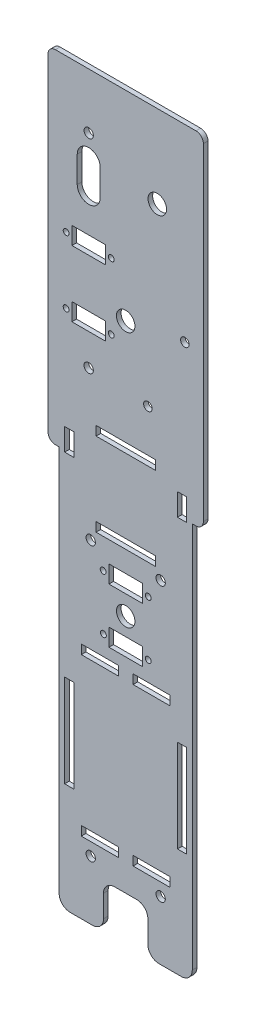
SolidWorks part; units mm, degrees
ref_plane "Front Plane" through (0, 0, 0) normal (0, 0, 1) x (1, 0, 0)
ref_plane "Top Plane" through (0, 0, 0) normal (0, 1, 0) x (1, 0, 0)
ref_plane "Right Plane" through (0, 0, 0) normal (1, 0, 0) x (0, 0, -1)
sketch "Sketch1" plane through (0, 0, 0) normal (0, 0, 1) x (1, 0, 0)
  line L1 (-26.67, -127) -> (26.67, -127)
  line L2 (-26.67, -127) -> (-26.67, 127)
  line L3 (-26.67, 127) -> (26.67, 127)
  line L4 (26.67, -127) -> (26.67, 127)
  line L5 (-26.67, -127) -> (26.67, 127) construction
  line L6 (-26.67, 127) -> (26.67, -127) construction
  point P0 (0, 0)
  dimension "D1" = 254
  dimension "D2" = 53.34
extrude "Boss-Extrude1" add sketch "Sketch1" along normal blind 1.5875
sketch "Sketch2" plane through (0, 0, 1.5875) normal (0, 0, 1) x (1, 0, 0)
  line L0 (0, 127) -> (0, -127) construction
  line L1 (26.67, 127) -> (-26.67, 127) construction
  line L2 (-26.67, -127) -> (26.67, -127) construction
  line L3 (35.56, -130.175) -> (22.86, -130.175)
  line L4 (-35.56, 9.525) -> (-22.86, 9.525)
  line L5 (-35.56, 9.525) -> (-35.56, -130.175)
  line L6 (-35.56, -130.175) -> (-22.86, -130.175)
  line L7 (-22.86, 9.525) -> (-22.86, -130.175)
  line L8 (22.86, 9.525) -> (22.86, -130.175)
  line L9 (35.56, 9.525) -> (22.86, 9.525)
  line L10 (35.56, 9.525) -> (35.56, -130.175)
  dimension "D1" = 139.7
  dimension "D2" = 22.86
  dimension "D3" = 117.475
  dimension "D4" = 12.7
extrude "Cut-Extrude1" cut sketch "Sketch2" against normal through all
sketch "Sketch3" plane through (0, 0, 1.5875) normal (0, 0, 1) x (1, 0, 0)
  line L0 (0, -127) -> (0, 0.6319) construction
  line L1 (-22.86, -127) -> (22.86, -127) construction
  line L3 (-7.62, -111.76) -> (7.62, -111.76)
  line L4 (-7.62, -111.76) -> (-7.62, -149.86)
  line L5 (-7.62, -149.86) -> (7.62, -149.86)
  line L6 (7.62, -111.76) -> (7.62, -149.86)
  line L7 (-7.62, -111.76) -> (7.62, -149.86) construction
  line L8 (-7.62, -149.86) -> (7.62, -111.76) construction
  point P5 (0, -130.81)
  dimension "D1" = 38.1
  dimension "D2" = 15.24
  dimension "D3" = 22.86
extrude "Cut-Extrude2" cut sketch "Sketch3" against normal through all
fillet "Fillet1" radius 3.81 6 edges at (-7.62, -111.76, 0.7937) (7.62, -111.76, 0.7937) (22.86, -127, 0.7937) (7.62, -127, 0.7937) (-7.62, -127, 0.7937) (-22.86, -127, 0.7937)
fillet "Fillet2" radius 2.54 4 edges at (-26.67, 9.525, 0.7937) (26.67, 9.525, 0.7937) (-26.67, 127, 0.7937) (26.67, 127, 0.7937)
hole_wizard "#4 Clearance Hole1" positions "Sketch5" profile "Sketch6" hole size "#4" standard "ANSI Inch"
sketch "Sketch5" plane through (0, 0, 1.5875) normal (0, 0, 1) x (1, 0, 0)
  line L0 (0, 127) -> (0, -111.76) construction
  line L1 (24.13, 127) -> (-24.13, 127) construction
  line L2 (3.81, -111.76) -> (-3.81, -111.76) construction
  point P8 (20.32, 62.23)
  point P10 (7.62, 36.83)
  point P14 (-39.4496, 54.198)
  dimension "D1" = 64.77
  dimension "D2" = 90.17
  dimension "D3" = 20.32
  dimension "D4" = 7.62
sketch "Sketch6" plane through (-39.4496, 54.198, 1.5875) normal (1, 0, 0) x (0, -1, 0)
  line L0 (0, 0) -> (0, 1.5875)
  line L1 (0, 1.5875) -> (1.4732, 1.5875)
  line L2 (1.4732, 1.5875) -> (1.4732, 0)
  line L5 (1.4732, 0) -> (0, 0)
  line L11 (0, -6.35) -> (0, 107.95) construction
  dimension "Thru Hole Dia." = 2.9464
  dimension "Thru Hole Depth" = 1.5875
sketch "Sketch7" plane through (0, 0, 1.5875) normal (0, 0, 1) x (1, 0, 0)
  line L0 (0, 127) -> (0, -111.76) construction
  line L1 (24.13, 127) -> (-24.13, 127) construction
  line L2 (3.81, -111.76) -> (-3.81, -111.76) construction
  line L4 (-15, -9.7355) -> (15, -9.7355)
  line L5 (-15, -9.7355) -> (-15, -109.7355)
  line L6 (-15, -109.7355) -> (15, -109.7355)
  line L7 (15, -9.7355) -> (15, -109.7355)
  line L8 (-15, -9.7355) -> (15, -109.7355) construction
  line L9 (-15, -109.7355) -> (15, -9.7355) construction
  point P6 (0, -59.7355)
  dimension "D1" = 100
  dimension "D2" = 30
hole_wizard "M3 Clearance Hole2" positions "Sketch8" profile "Sketch9" hole size "M3" standard "ANSI Metric"
sketch "Sketch8" plane through (0, 0, 1.5875) normal (0, 0, 1) x (1, 0, 0)
  line L0 (-15, -9.7355) -> (15, -9.7355) construction
  line L1 (-15, -9.7355) -> (-15, -109.7355) construction
  line L2 (15, -9.7355) -> (15, -109.7355) construction
  line L3 (-15, -109.7355) -> (15, -109.7355) construction
  point P0 (-12, -12.7355)
  point P2 (12, -12.7355)
  point P4 (12, -106.7355)
  point P6 (-12, -106.7355)
  dimension "D1" = 3
  dimension "D2" = 3
  dimension "D3" = 3
  dimension "D4" = 3
  dimension "D5" = 3
  dimension "D6" = 3
  dimension "D7" = 3
  dimension "D8" = 3
sketch "Sketch9" plane through (-12, -12.7355, 1.5875) normal (1, 0, 0) x (0, -1, 0)
  line L0 (0, 0) -> (0, 1.5875)
  line L1 (0, 1.5875) -> (1.6, 1.5875)
  line L2 (1.6, 1.5875) -> (1.6, 0)
  line L5 (1.6, 0) -> (0, 0)
  line L11 (0, -6.35) -> (0, 107.95) construction
  dimension "Thru Hole Dia." = 3.2
  dimension "Thru Hole Depth" = 1.5875
hole_wizard "M3 Clearance Hole3" positions "Sketch10" profile "Sketch11" hole size "M3" standard "ANSI Metric"
sketch "Sketch10" plane through (0, 0, 1.5875) normal (0, 0, 1) x (1, 0, 0)
  line L0 (-12.7, 127) -> (-12.7, 6.0622) construction
  line L1 (24.13, 127) -> (-24.13, 127) construction
  line L3 (0, 127) -> (0, -111.76) construction
  point P9 (-12.7, 107.95)
  point P11 (-12.7, 38.1)
  dimension "D1" = 12.7
  dimension "D2" = 19.05
  dimension "D3" = 69.85
sketch "Sketch11" plane through (-12.7, 38.1, 1.5875) normal (1, 0, 0) x (0, -1, 0)
  line L0 (0, 0) -> (0, 1.5875)
  line L1 (0, 1.5875) -> (1.6, 1.5875)
  line L2 (1.6, 1.5875) -> (1.6, 0)
  line L5 (1.6, 0) -> (0, 0)
  line L11 (0, -6.35) -> (0, 107.95) construction
  dimension "Thru Hole Dia." = 3.2
  dimension "Thru Hole Depth" = 1.5875
sketch "Sketch12" plane through (0, 0, 1.5875) normal (0, 0, 1) x (1, 0, 0)
  line L0 (0, 127) -> (0, -111.76) construction
  line L1 (17.78, -57.9609) -> (20.955, -57.9609)
  line L2 (17.78, -57.9609) -> (17.78, -89.7109)
  line L3 (17.78, -89.7109) -> (20.955, -89.7109)
  line L4 (20.955, -57.9609) -> (20.955, -89.7109)
  line L5 (17.78, -57.9609) -> (20.955, -89.7109) construction
  line L6 (17.78, -89.7109) -> (20.955, -57.9609) construction
  line L7 (-15.0182, -73.8359) -> (15.24, -73.8359) construction
  line L8 (2.54, -45.2609) -> (15.24, -45.2609)
  line L9 (2.54, -45.2609) -> (2.54, -48.4359)
  line L10 (2.54, -48.4359) -> (15.24, -48.4359)
  line L11 (15.24, -45.2609) -> (15.24, -48.4359)
  line L12 (2.54, -45.2609) -> (15.24, -48.4359) construction
  line L13 (2.54, -48.4359) -> (15.24, -45.2609) construction
  line L14 (2.54, -99.2359) -> (15.24, -102.4109) construction
  line L15 (2.54, -102.4109) -> (15.24, -99.2359) construction
  line L16 (15.24, -102.4109) -> (15.24, -99.2359)
  line L17 (2.54, -99.2359) -> (15.24, -99.2359)
  line L18 (2.54, -102.4109) -> (2.54, -99.2359)
  line L19 (2.54, -102.4109) -> (15.24, -102.4109)
  line L20 (0, -35.1674) -> (0, -106.1323) construction
  line L21 (-2.54, -48.4359) -> (-15.24, -45.2609) construction
  line L22 (-2.54, -45.2609) -> (-15.24, -48.4359) construction
  line L23 (-15.24, -45.2609) -> (-15.24, -48.4359)
  line L24 (-2.54, -48.4359) -> (-15.24, -48.4359)
  line L25 (-2.54, -45.2609) -> (-2.54, -48.4359)
  line L26 (-2.54, -45.2609) -> (-15.24, -45.2609)
  line L27 (-2.54, -102.4109) -> (-15.24, -99.2359) construction
  line L28 (-2.54, -99.2359) -> (-15.24, -102.4109) construction
  line L29 (-2.54, -102.4109) -> (-15.24, -102.4109)
  line L30 (-2.54, -102.4109) -> (-2.54, -99.2359)
  line L31 (-2.54, -99.2359) -> (-15.24, -99.2359)
  line L32 (-15.24, -102.4109) -> (-15.24, -99.2359)
  line L33 (-17.78, -89.7109) -> (-20.955, -57.9609) construction
  line L34 (-17.78, -57.9609) -> (-20.955, -89.7109) construction
  line L35 (-20.955, -57.9609) -> (-20.955, -89.7109)
  line L36 (-17.78, -89.7109) -> (-20.955, -89.7109)
  line L37 (-17.78, -57.9609) -> (-17.78, -89.7109)
  line L38 (-17.78, -57.9609) -> (-20.955, -57.9609)
  circle A0 centre (12, -106.7355) radius 1.6 construction
  point P0 (19.3675, -73.8359)
  point P7 (8.89, -46.8484)
  point P20 (8.89, -100.8234)
  point P28 (-8.89, -46.8484)
  point P33 (-8.89, -100.8234)
  point P38 (-19.3675, -73.8359)
  dimension "D1" = 3.175
  dimension "D2" = 31.75
  dimension "D3" = 17.78
  dimension "D4" = 3.175
  dimension "D5" = 12.7
  dimension "D6" = 8.89
  dimension "D7" = 32.8996
  dimension "D8" = 25.4
extrude "Cut-Extrude3" cut sketch "Sketch12" against normal through all
sketch "Sketch13" plane through (0, 0, 1.5875) normal (0, 0, 1) x (1, 0, 0)
  line L0 (0, 50.9824) -> (0, -22.1444) construction
  line L1 (-22.86, 6.3812) -> (22.86, 6.3812) construction
  line L2 (-10.16, -6.3188) -> (10.16, -6.3188)
  line L3 (-10.16, -6.3188) -> (-10.16, -9.4938)
  line L4 (-10.16, -9.4938) -> (10.16, -9.4938)
  line L5 (10.16, -6.3188) -> (10.16, -9.4938)
  line L6 (-10.16, -6.3188) -> (10.16, -9.4938) construction
  line L7 (-10.16, -9.4938) -> (10.16, -6.3188) construction
  line L8 (-22.86, -123.19) -> (-22.86, 9.525) construction
  line L9 (22.86, 9.525) -> (22.86, -123.19) construction
  line L10 (-10.16, 22.2562) -> (10.16, 19.0812) construction
  line L11 (-10.16, 19.0812) -> (10.16, 22.2562) construction
  line L12 (10.16, 19.0812) -> (10.16, 22.2562)
  line L13 (-10.16, 22.2562) -> (10.16, 22.2562)
  line L14 (-10.16, 19.0812) -> (-10.16, 22.2562)
  line L15 (-10.16, 19.0812) -> (10.16, 19.0812)
  line L16 (-17.78, 8.9212) -> (-20.955, 16.5412) construction
  line L17 (17.78, 16.5412) -> (20.955, 16.5412)
  line L18 (17.78, 16.5412) -> (17.78, 8.9212)
  line L19 (17.78, 8.9212) -> (20.955, 8.9212)
  line L20 (20.955, 16.5412) -> (20.955, 8.9212)
  line L21 (17.78, 16.5412) -> (20.955, 8.9212) construction
  line L22 (17.78, 8.9212) -> (20.955, 16.5412) construction
  line L23 (-17.78, 16.5412) -> (-20.955, 8.9212) construction
  line L24 (-20.955, 16.5412) -> (-20.955, 8.9212)
  line L25 (-17.78, 8.9212) -> (-20.955, 8.9212)
  line L26 (-17.78, 16.5412) -> (-17.78, 8.9212)
  line L27 (-17.78, 16.5412) -> (-20.955, 16.5412)
  point P3 (0, -7.9063)
  point P19 (0, 20.6687)
  point P20 (19.3675, 12.7312)
  point P28 (-19.3675, 12.7312)
  dimension "D1" = 3.175
  dimension "D2" = 20.32
  dimension "D3" = 25.4
  dimension "D4" = 7.62
  dimension "D5" = 3.175
  dimension "D6" = 17.78
  dimension "D7" = 6.35
extrude "Cut-Extrude4" cut sketch "Sketch13" against normal through all
sketch "Sketch15" plane through (0, 0, 1.5875) normal (0, 0, 1) x (1, 0, 0)
  line L0 (-12.7, 107.95) -> (-12.7, 38.1) construction
  line L1 (-12.7, 99.6778) -> (-12.7, 90.658) construction
  line L2 (-8.7632, 99.6778) -> (-8.7632, 90.658)
  line L3 (-16.6368, 99.6778) -> (-16.6368, 90.658)
  arc A0 (-8.7632, 99.6778) -> (-16.6368, 99.6778) centre (-12.7, 99.6778) ccw
  arc A1 (-16.6368, 90.658) -> (-8.7632, 90.658) centre (-12.7, 90.658) ccw
  point P6 (-12.7, 95.1679)
extrude "Cut-Extrude5" cut sketch "Sketch15" against normal blind 2.54
hole_wizard "1/4 (0.25) Diameter Hole1" positions "Sketch16" profile "Sketch17" hole size "1/4" standard "ANSI Inch"
sketch "Sketch16" plane through (0, 0, 1.5875) normal (0, 0, 1) x (1, 0, 0)
  point P0 (10.846, 98.5861)
  point P2 (0, 58.4037)
  point P4 (0, -29.3846)
sketch "Sketch17" plane through (10.846, 98.5861, 1.5875) normal (1, 0, 0) x (0, -1, 0)
  line L0 (0, 0) -> (0, 1.5875)
  line L1 (0, 1.5875) -> (3.175, 1.5875)
  line L2 (3.175, 1.5875) -> (3.175, 0)
  line L5 (3.175, 0) -> (0, 0)
  line L11 (0, -6.35) -> (0, 107.95) construction
  dimension "Thru Hole Dia." = 6.35
  dimension "Thru Hole Depth" = 1.5875
sketch "Sketch19" plane through (0, 0, 1.5875) normal (0, 0, 1) x (1, 0, 0)
  line L0 (-12.7, 107.95) -> (-12.7, 38.1) construction
  line L2 (-18.4531, 54.9218) -> (-6.9469, 54.9218)
  line L3 (-18.4531, 54.9218) -> (-18.4531, 48.9274)
  line L4 (-18.4531, 48.9274) -> (-6.9469, 48.9274)
  line L5 (-6.9469, 54.9218) -> (-6.9469, 48.9274)
  line L6 (-18.4531, 54.9218) -> (-6.9469, 48.9274) construction
  line L7 (-18.4531, 48.9274) -> (-6.9469, 54.9218) construction
  line L12 (-18.4531, 77.5988) -> (-6.9469, 77.5988)
  line L13 (-18.4531, 77.5988) -> (-18.4531, 71.6044)
  line L14 (-18.4531, 71.6044) -> (-6.9469, 71.6044)
  line L15 (-6.9469, 77.5988) -> (-6.9469, 71.6044)
  line L16 (-18.4531, 77.5988) -> (-6.9469, 71.6044) construction
  line L17 (-18.4531, 71.6044) -> (-6.9469, 77.5988) construction
  line L18 (0, 0) -> (0, -49.6154) construction
  line L19 (-5.7531, -16.7189) -> (5.7531, -16.7189)
  line L24 (-5.7531, -16.7189) -> (-5.7531, -22.7133)
  line L25 (-5.7531, -22.7133) -> (5.7531, -22.7133)
  line L26 (5.7531, -16.7189) -> (5.7531, -22.7133)
  line L31 (-5.7531, -16.7189) -> (5.7531, -22.7133) construction
  line L32 (-5.7531, -22.7133) -> (5.7531, -16.7189) construction
  line L33 (-5.7531, -35.506) -> (5.7531, -35.506)
  line L34 (-5.7531, -35.506) -> (-5.7531, -41.5004)
  line L35 (-5.7531, -41.5004) -> (5.7531, -41.5004)
  line L36 (5.7531, -35.506) -> (5.7531, -41.5004)
  line L37 (-5.7531, -35.506) -> (5.7531, -41.5004) construction
  line L38 (-5.7531, -41.5004) -> (5.7531, -35.506) construction
  circle A10 centre (-4.953, 74.6016) radius 1.0033
  circle A11 centre (-20.447, 74.6016) radius 1.0033
  circle A12 centre (-4.953, 51.9246) radius 1.0033
  circle A13 centre (-20.447, 51.9246) radius 1.0033
  circle A14 centre (7.747, -19.7161) radius 1.0033
  circle A15 centre (-7.747, -19.7161) radius 1.0033
  circle A16 centre (7.747, -38.5032) radius 1.0033
  circle A17 centre (-7.6454, -38.5032) radius 1.0033
  point P4 (-12.7, 51.9246)
  point P14 (-12.7, 74.6016)
  point P22 (0, -19.7161)
  point P30 (0, -38.5032)
  dimension "D5" = 2.0066
  dimension "D6" = 2.0066
  dimension "D11" = 2.0066
  dimension "D12" = 2.0066
  dimension "D17" = 7.747
  dimension "D18" = 7.747
  dimension "D21" = 2.0066
  dimension "D22" = 2.0066
  dimension "D23" = 2.0066
  dimension "D24" = 2.0066
  dimension "D1" = 5.9944
  dimension "D2" = 11.5062
  dimension "D3" = 7.747
  dimension "D4" = 7.747
  dimension "D7" = 5.9944
  dimension "D8" = 11.5062
  dimension "D9" = 7.747
  dimension "D10" = 7.747
  dimension "D13" = 11.5062
  dimension "D14" = 5.9944
  dimension "D15" = 5.9944
  dimension "D16" = 11.5062
  dimension "D19" = 7.747
  dimension "D20" = 7.6454
extrude "Cut-Extrude6" cut sketch "Sketch19" against normal through all
sketch "Sketch20" plane through (0, 0, 1.5875) normal (0, 0, 1) x (1, 0, 0)
  line L16 (-9.0172, 90.658) -> (-9.0172, 99.6778)
  line L17 (-16.3828, 99.6778) -> (-16.3828, 90.658)
  line L18 (-9.0172, 90.658) -> (-9.0172, 99.6778)
  line L19 (-16.3828, 99.6778) -> (-16.3828, 90.658)
  line L24 (-26.924, 124.46) -> (-26.924, 12.065)
  line L25 (-24.13, 9.271) -> (-23.114, 9.271)
  line L26 (-23.114, 9.271) -> (-23.114, -123.19)
  line L27 (-19.05, -127.254) -> (-11.43, -127.254)
  line L28 (-7.366, -123.19) -> (-7.366, -115.57)
  line L29 (-3.81, -112.014) -> (3.81, -112.014)
  line L30 (7.366, -115.57) -> (7.366, -123.19)
  line L31 (11.43, -127.254) -> (19.05, -127.254)
  line L32 (23.114, -123.19) -> (23.114, 9.271)
  line L33 (23.114, 9.271) -> (24.13, 9.271)
  line L34 (26.924, 12.065) -> (26.924, 124.46)
  line L35 (24.13, 127.254) -> (-24.13, 127.254)
  line L36 (-26.924, 124.46) -> (-26.924, 12.065)
  line L37 (-24.13, 9.271) -> (-23.114, 9.271)
  line L38 (-23.114, 9.271) -> (-23.114, -123.19)
  line L39 (-19.05, -127.254) -> (-11.43, -127.254)
  line L40 (-7.366, -123.19) -> (-7.366, -115.57)
  line L41 (-3.81, -112.014) -> (3.81, -112.014)
  line L42 (7.366, -115.57) -> (7.366, -123.19)
  line L43 (11.43, -127.254) -> (19.05, -127.254)
  line L44 (23.114, -123.19) -> (23.114, 9.271)
  line L45 (23.114, 9.271) -> (24.13, 9.271)
  line L46 (26.924, 12.065) -> (26.924, 124.46)
  line L47 (24.13, 127.254) -> (-24.13, 127.254)
  line L50 (-18.1991, 71.8584) -> (-7.2009, 71.8584)
  line L51 (-7.2009, 71.8584) -> (-7.2009, 77.3448)
  line L52 (-18.1991, 77.3448) -> (-18.1991, 71.8584)
  line L53 (-7.2009, 77.3448) -> (-18.1991, 77.3448)
  line L54 (-18.1991, 71.8584) -> (-7.2009, 71.8584)
  line L55 (-7.2009, 71.8584) -> (-7.2009, 77.3448)
  line L56 (-18.1991, 77.3448) -> (-18.1991, 71.8584)
  line L57 (-7.2009, 77.3448) -> (-18.1991, 77.3448)
  line L62 (-18.1991, 49.1814) -> (-7.2009, 49.1814)
  line L63 (-7.2009, 49.1814) -> (-7.2009, 54.6678)
  line L64 (-18.1991, 54.6678) -> (-18.1991, 49.1814)
  line L65 (-7.2009, 54.6678) -> (-18.1991, 54.6678)
  line L66 (-18.1991, 49.1814) -> (-7.2009, 49.1814)
  line L67 (-7.2009, 49.1814) -> (-7.2009, 54.6678)
  line L68 (-18.1991, 54.6678) -> (-18.1991, 49.1814)
  line L69 (-7.2009, 54.6678) -> (-18.1991, 54.6678)
  line L74 (9.906, 19.3352) -> (9.906, 22.0022)
  line L75 (-9.906, 19.3352) -> (9.906, 19.3352)
  line L76 (-9.906, 22.0022) -> (-9.906, 19.3352)
  line L77 (9.906, 22.0022) -> (-9.906, 22.0022)
  line L78 (9.906, 19.3352) -> (9.906, 22.0022)
  line L79 (-9.906, 19.3352) -> (9.906, 19.3352)
  line L80 (-9.906, 22.0022) -> (-9.906, 19.3352)
  line L81 (9.906, 22.0022) -> (-9.906, 22.0022)
  line L86 (-20.701, 9.1752) -> (-18.034, 9.1752)
  line L87 (-18.034, 9.1752) -> (-18.034, 16.2872)
  line L88 (-18.034, 16.2872) -> (-20.701, 16.2872)
  line L89 (-20.701, 16.2872) -> (-20.701, 9.1752)
  line L90 (-20.701, 9.1752) -> (-18.034, 9.1752)
  line L91 (-18.034, 9.1752) -> (-18.034, 16.2872)
  line L92 (-18.034, 16.2872) -> (-20.701, 16.2872)
  line L93 (-20.701, 16.2872) -> (-20.701, 9.1752)
  line L94 (-26.67, 124.46) -> (-26.67, 12.065)
  line L95 (-24.13, 9.525) -> (-22.86, 9.525)
  line L96 (-22.86, 9.525) -> (-22.86, -123.19)
  line L97 (-19.05, -127) -> (-11.43, -127)
  line L98 (20.701, 9.1752) -> (20.701, 16.2872)
  line L99 (20.701, 16.2872) -> (18.034, 16.2872)
  line L100 (18.034, 16.2872) -> (18.034, 9.1752)
  line L101 (18.034, 9.1752) -> (20.701, 9.1752)
  line L102 (20.701, 9.1752) -> (20.701, 16.2872)
  line L103 (20.701, 16.2872) -> (18.034, 16.2872)
  line L104 (18.034, 16.2872) -> (18.034, 9.1752)
  line L105 (18.034, 9.1752) -> (20.701, 9.1752)
  line L106 (-7.62, -123.19) -> (-7.62, -115.57)
  line L107 (-3.81, -111.76) -> (3.81, -111.76)
  line L108 (7.62, -115.57) -> (7.62, -123.19)
  line L109 (11.43, -127) -> (19.05, -127)
  line L110 (22.86, -123.19) -> (22.86, 9.525)
  line L111 (22.86, 9.525) -> (24.13, 9.525)
  line L112 (26.67, 12.065) -> (26.67, 124.46)
  line L113 (24.13, 127) -> (-24.13, 127)
  line L122 (9.906, -9.2398) -> (9.906, -6.5728)
  line L123 (-9.906, -9.2398) -> (9.906, -9.2398)
  line L124 (-9.906, -6.5728) -> (-9.906, -9.2398)
  line L125 (9.906, -6.5728) -> (-9.906, -6.5728)
  line L126 (9.906, -9.2398) -> (9.906, -6.5728)
  line L127 (-9.906, -9.2398) -> (9.906, -9.2398)
  line L128 (-9.906, -6.5728) -> (-9.906, -9.2398)
  line L129 (9.906, -6.5728) -> (-9.906, -6.5728)
  line L134 (5.4991, -22.4593) -> (5.4991, -16.9729)
  line L135 (-5.4991, -22.4593) -> (5.4991, -22.4593)
  line L136 (-5.4991, -16.9729) -> (-5.4991, -22.4593)
  line L137 (5.4991, -16.9729) -> (-5.4991, -16.9729)
  line L138 (5.4991, -22.4593) -> (5.4991, -16.9729)
  line L139 (-5.4991, -22.4593) -> (5.4991, -22.4593)
  line L140 (-5.4991, -16.9729) -> (-5.4991, -22.4593)
  line L141 (5.4991, -16.9729) -> (-5.4991, -16.9729)
  line L146 (-5.4991, -41.2464) -> (5.4991, -41.2464)
  line L147 (5.4991, -41.2464) -> (5.4991, -35.76)
  line L148 (-5.4991, -35.76) -> (-5.4991, -41.2464)
  line L149 (5.4991, -35.76) -> (-5.4991, -35.76)
  line L150 (-5.4991, -41.2464) -> (5.4991, -41.2464)
  line L151 (5.4991, -41.2464) -> (5.4991, -35.76)
  line L152 (-5.4991, -35.76) -> (-5.4991, -41.2464)
  line L153 (5.4991, -35.76) -> (-5.4991, -35.76)
  line L158 (-2.794, -48.1819) -> (-2.794, -45.5149)
  line L159 (-2.794, -45.5149) -> (-14.986, -45.5149)
  line L160 (-14.986, -45.5149) -> (-14.986, -48.1819)
  line L161 (-14.986, -48.1819) -> (-2.794, -48.1819)
  line L162 (-2.794, -48.1819) -> (-2.794, -45.5149)
  line L163 (-2.794, -45.5149) -> (-14.986, -45.5149)
  line L164 (-14.986, -45.5149) -> (-14.986, -48.1819)
  line L165 (-14.986, -48.1819) -> (-2.794, -48.1819)
  line L170 (14.986, -48.1819) -> (14.986, -45.5149)
  line L171 (14.986, -45.5149) -> (2.794, -45.5149)
  line L172 (2.794, -45.5149) -> (2.794, -48.1819)
  line L173 (2.794, -48.1819) -> (14.986, -48.1819)
  line L174 (14.986, -48.1819) -> (14.986, -45.5149)
  line L175 (14.986, -45.5149) -> (2.794, -45.5149)
  line L176 (2.794, -45.5149) -> (2.794, -48.1819)
  line L177 (2.794, -48.1819) -> (14.986, -48.1819)
  line L182 (-20.701, -89.4569) -> (-18.034, -89.4569)
  line L183 (-20.701, -58.2149) -> (-20.701, -89.4569)
  line L184 (-18.034, -58.2149) -> (-20.701, -58.2149)
  line L185 (-18.034, -89.4569) -> (-18.034, -58.2149)
  line L186 (-20.701, -89.4569) -> (-18.034, -89.4569)
  line L187 (-20.701, -58.2149) -> (-20.701, -89.4569)
  line L188 (-18.034, -58.2149) -> (-20.701, -58.2149)
  line L189 (-18.034, -89.4569) -> (-18.034, -58.2149)
  line L194 (18.034, -89.4569) -> (20.701, -89.4569)
  line L195 (20.701, -89.4569) -> (20.701, -58.2149)
  line L196 (20.701, -58.2149) -> (18.034, -58.2149)
  line L197 (18.034, -58.2149) -> (18.034, -89.4569)
  line L198 (18.034, -89.4569) -> (20.701, -89.4569)
  line L199 (20.701, -89.4569) -> (20.701, -58.2149)
  line L200 (20.701, -58.2149) -> (18.034, -58.2149)
  line L201 (18.034, -58.2149) -> (18.034, -89.4569)
  line L206 (-2.794, -102.1569) -> (-2.794, -99.4899)
  line L207 (-14.986, -102.1569) -> (-2.794, -102.1569)
  line L208 (-14.986, -99.4899) -> (-14.986, -102.1569)
  line L209 (-2.794, -99.4899) -> (-14.986, -99.4899)
  line L210 (-2.794, -102.1569) -> (-2.794, -99.4899)
  line L211 (-14.986, -102.1569) -> (-2.794, -102.1569)
  line L212 (-14.986, -99.4899) -> (-14.986, -102.1569)
  line L213 (-2.794, -99.4899) -> (-14.986, -99.4899)
  line L216 (15.24, -99.4899) -> (2.794, -99.4899)
  line L217 (2.794, -99.4899) -> (2.794, -102.1569)
  line L218 (2.794, -102.1569) -> (15.24, -102.1569)
  line L219 (15.24, -99.4899) -> (2.794, -99.4899)
  line L220 (2.794, -99.4899) -> (2.794, -102.1569)
  line L221 (2.794, -102.1569) -> (15.24, -102.1569)
  circle A12 centre (-12.7, 107.95) radius 1.346
  circle A13 centre (-12.7, 107.95) radius 1.346
  arc A17 (-16.3828, 90.658) -> (-9.0172, 90.658) centre (-12.7, 90.658) ccw
  arc A18 (-9.0172, 99.6778) -> (-16.3828, 99.6778) centre (-12.7, 99.6778) ccw
  arc A19 (-16.3828, 90.658) -> (-9.0172, 90.658) centre (-12.7, 90.658) ccw
  arc A20 (-26.924, 12.065) -> (-24.13, 9.271) centre (-24.13, 12.065) ccw
  arc A21 (-23.114, -123.19) -> (-19.05, -127.254) centre (-19.05, -123.19) ccw
  arc A22 (-11.43, -127.254) -> (-7.366, -123.19) centre (-11.43, -123.19) ccw
  arc A23 (-3.81, -112.014) -> (-7.366, -115.57) centre (-3.81, -115.57) ccw
  arc A24 (7.366, -115.57) -> (3.81, -112.014) centre (3.81, -115.57) ccw
  arc A25 (7.366, -123.19) -> (11.43, -127.254) centre (11.43, -123.19) ccw
  arc A26 (19.05, -127.254) -> (23.114, -123.19) centre (19.05, -123.19) ccw
  arc A27 (24.13, 9.271) -> (26.924, 12.065) centre (24.13, 12.065) ccw
  arc A28 (26.924, 124.46) -> (24.13, 127.254) centre (24.13, 124.46) ccw
  arc A29 (-24.13, 127.254) -> (-26.924, 124.46) centre (-24.13, 124.46) ccw
  arc A30 (-26.924, 12.065) -> (-24.13, 9.271) centre (-24.13, 12.065) ccw
  arc A31 (-23.114, -123.19) -> (-19.05, -127.254) centre (-19.05, -123.19) ccw
  arc A32 (-11.43, -127.254) -> (-7.366, -123.19) centre (-11.43, -123.19) ccw
  arc A33 (-3.81, -112.014) -> (-7.366, -115.57) centre (-3.81, -115.57) ccw
  arc A34 (7.366, -115.57) -> (3.81, -112.014) centre (3.81, -115.57) ccw
  arc A35 (7.366, -123.19) -> (11.43, -127.254) centre (11.43, -123.19) ccw
  arc A36 (19.05, -127.254) -> (23.114, -123.19) centre (19.05, -123.19) ccw
  arc A37 (24.13, 9.271) -> (26.924, 12.065) centre (24.13, 12.065) ccw
  arc A38 (26.924, 124.46) -> (24.13, 127.254) centre (24.13, 124.46) ccw
  arc A39 (-24.13, 127.254) -> (-26.924, 124.46) centre (-24.13, 124.46) ccw
  arc A40 (-9.0172, 99.6778) -> (-16.3828, 99.6778) centre (-12.7, 99.6778) ccw
  circle A41 centre (10.846, 98.5861) radius 2.921
  circle A42 centre (10.846, 98.5861) radius 2.921
  circle A44 centre (-20.447, 74.6016) radius 0.7493
  circle A45 centre (-20.447, 74.6016) radius 0.7493
  circle A47 centre (-4.953, 74.6016) radius 0.7493
  circle A48 centre (-4.953, 74.6016) radius 0.7493
  circle A50 centre (20.32, 62.23) radius 1.2192
  circle A51 centre (20.32, 62.23) radius 1.2192
  circle A53 centre (0, 58.4037) radius 2.921
  circle A54 centre (0, 58.4037) radius 2.921
  circle A56 centre (-20.447, 51.9246) radius 0.7493
  circle A57 centre (-20.447, 51.9246) radius 0.7493
  circle A59 centre (-4.953, 51.9246) radius 0.7493
  circle A60 centre (-4.953, 51.9246) radius 0.7493
  circle A62 centre (-12.7, 38.1) radius 1.346
  circle A63 centre (-12.7, 38.1) radius 1.346
  arc A64 (-26.67, 12.065) -> (-24.13, 9.525) centre (-24.13, 12.065) ccw
  circle A65 centre (7.62, 36.83) radius 1.2192
  circle A66 centre (7.62, 36.83) radius 1.2192
  arc A67 (-22.86, -123.19) -> (-19.05, -127) centre (-19.05, -123.19) ccw
  arc A68 (-11.43, -127) -> (-7.62, -123.19) centre (-11.43, -123.19) ccw
  arc A69 (-3.81, -111.76) -> (-7.62, -115.57) centre (-3.81, -115.57) ccw
  arc A70 (7.62, -115.57) -> (3.81, -111.76) centre (3.81, -115.57) ccw
  arc A71 (7.62, -123.19) -> (11.43, -127) centre (11.43, -123.19) ccw
  arc A72 (19.05, -127) -> (22.86, -123.19) centre (19.05, -123.19) ccw
  arc A73 (24.13, 9.525) -> (26.67, 12.065) centre (24.13, 12.065) ccw
  arc A74 (26.67, 124.46) -> (24.13, 127) centre (24.13, 124.46) ccw
  arc A75 (-24.13, 127) -> (-26.67, 124.46) centre (-24.13, 124.46) ccw
  circle A78 centre (-12, -12.7355) radius 1.346
  circle A79 centre (-12, -12.7355) radius 1.346
  circle A81 centre (12, -12.7355) radius 1.346
  circle A82 centre (12, -12.7355) radius 1.346
  circle A84 centre (-7.747, -19.7161) radius 0.7493
  circle A85 centre (-7.747, -19.7161) radius 0.7493
  circle A87 centre (7.747, -19.7161) radius 0.7493
  circle A88 centre (7.747, -19.7161) radius 0.7493
  circle A90 centre (0, -29.3846) radius 2.921
  circle A91 centre (0, -29.3846) radius 2.921
  circle A93 centre (-7.6454, -38.5032) radius 0.7493
  circle A94 centre (-7.6454, -38.5032) radius 0.7493
  circle A96 centre (7.747, -38.5032) radius 0.7493
  circle A97 centre (7.747, -38.5032) radius 0.7493
  circle A99 centre (-12, -106.7355) radius 1.346
  circle A100 centre (-12, -106.7355) radius 1.346
  circle A102 centre (12, -106.7355) radius 1.346
  circle A103 centre (12, -106.7355) radius 1.346
  dimension "D1" = 0.254
  dimension "D2" = 0.254
  dimension "D3" = 0.254
  dimension "D4" = 0.254
  dimension "D5" = 0.254
  dimension "D6" = 0.254
  dimension "D7" = 0.254
  dimension "D8" = 0.254
  dimension "D9" = 0.254
  dimension "D10" = 0.254
  dimension "D11" = 0.254
  dimension "D12" = 0.254
  dimension "D13" = 0.254
  dimension "D14" = 0.254
  dimension "D15" = 0.254
  dimension "D16" = 0.254
  dimension "D17" = 0.254
  dimension "D18" = 0.254
  dimension "D19" = 0.254
  dimension "D20" = 0.254
  dimension "D21" = 0.254
  dimension "D22" = 0.254
  dimension "D23" = 0.254
  dimension "D24" = 0.254
  dimension "D25" = 0.254
  dimension "D26" = 0.254
  dimension "D27" = 0.254
  dimension "D28" = 0.254
  dimension "D29" = 0.254
  dimension "D30" = 0.254
  dimension "D31" = 0.254
  dimension "D32" = 0.254
  dimension "D33" = 0.254
  dimension "D34" = 0.254
  dimension "D35" = 0.254
  dimension "D36" = 0.254
